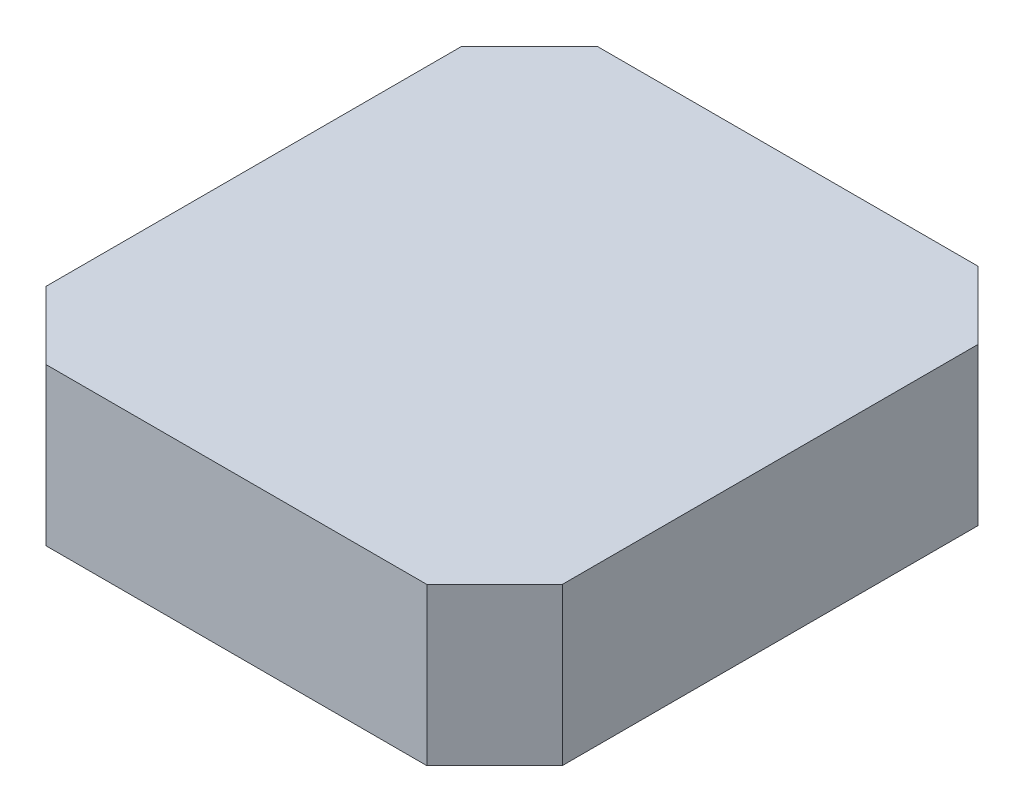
SolidWorks part; units mm, degrees
ref_plane "Front Plane" through (0, 0, 0) normal (0, 0, 1) x (1, 0, 0)
ref_plane "Top Plane" through (0, 0, 0) normal (0, 1, 0) x (1, 0, 0)
ref_plane "Right Plane" through (0, 0, 0) normal (1, 0, 0) x (0, 0, -1)
sketch "Sketch2" plane through (0, 0, 0) normal (0, 1, 0) x (1, 0, 0)
  line L8 (5.4586, 7.9) -> (-5.4586, 7.9)
  line L9 (-5.4586, 7.9) -> (-7.4, 5.9586)
  line L10 (-7.4, 5.9586) -> (-7.4, -5.9586)
  line L11 (-5.4586, -7.9) -> (-7.4, -5.9586)
  line L12 (5.4586, -7.9) -> (-5.4586, -7.9)
  line L13 (7.4, -5.9586) -> (5.4586, -7.9)
  line L14 (7.4, 5.9586) -> (7.4, -5.9586)
  line L15 (5.4586, 7.9) -> (7.4, 5.9586)
  point P4 (-5.5, 8)
  point P5 (-5.5, -8)
  point P6 (5.5, 8)
  point P7 (5.5, -8)
extrude "Boss-Extrude1" add sketch "Sketch2" along normal blind 4.5
